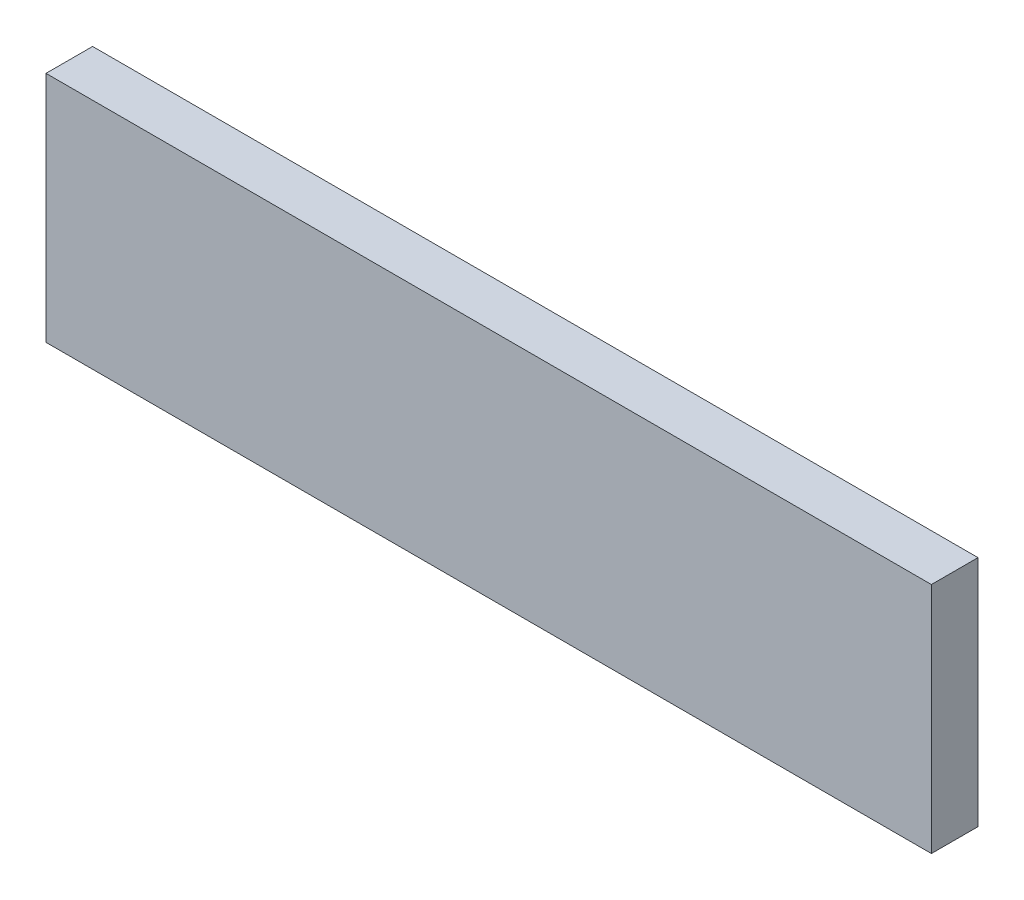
SolidWorks part; units mm, degrees
ref_plane "Plan de face" through (0, 0, 0) normal (0, 0, 1) x (1, 0, 0)
ref_plane "Plan de dessus" through (0, 0, 0) normal (0, 1, 0) x (1, 0, 0)
ref_plane "Plan de droite" through (0, 0, 0) normal (1, 0, 0) x (0, 0, -1)
sketch "Esquisse1" plane through (0, 0, 0) normal (0, 0, 1) x (1, 0, 0)
  line L1 (-60, 30) -> (54, 30)
  line L2 (-60, 30) -> (-60, 0)
  line L3 (-60, 0) -> (54, 0)
  line L4 (54, 30) -> (54, 0)
  dimension "D1" = 114
  dimension "D2" = 30
extrude "Extrusion1" add sketch "Esquisse1" along normal blind 6
